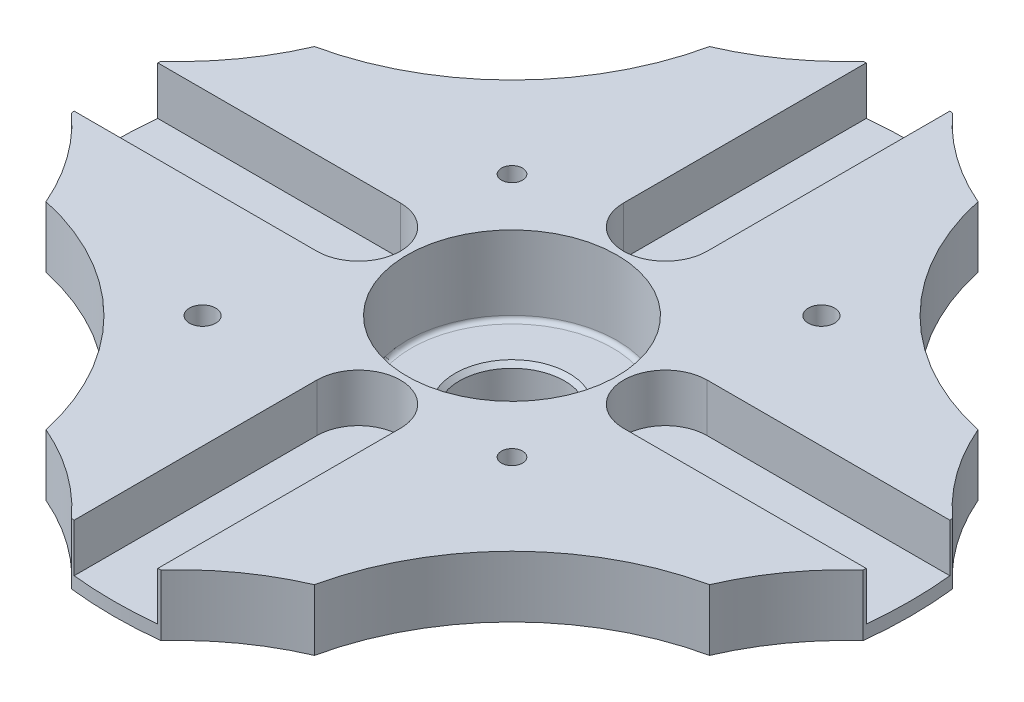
SolidWorks part; units mm, degrees
ref_plane "Plan1" through (0, 0, 0) normal (0, 0, 1) x (1, 0, 0)
ref_plane "Plan2" through (0, 0, 0) normal (0, 1, 0) x (1, 0, 0)
ref_plane "Plan3" through (0, 0, 0) normal (1, 0, 0) x (0, 0, -1)
sketch "Esquisse1" plane through (0, 0, 0) normal (0, 0, 1) x (1, 0, 0)
  line L0 (0, 0) -> (0, 107.1671) construction
  line L2 (24, 45.9) -> (24, 28)
  line L3 (24, 28) -> (12, 28)
  line L4 (12, 28) -> (12, 0)
  line L5 (12, 0) -> (19, 0)
  line L6 (19, 0) -> (19, 18)
  line L7 (19, 18) -> (29, 18)
  line L8 (29, 18) -> (29, 31.9)
  line L9 (29, 31.9) -> (91, 31.9)
  line L10 (91, 31.9) -> (91, 45.9)
  line L11 (24, 45.9) -> (91, 45.9)
  dimension "D1" = 91
  dimension "D2" = 29
  dimension "D3" = 19
  dimension "D4" = 24
  dimension "D5" = 12
  dimension "D6" = 14
  dimension "D7" = 13.9
  dimension "D8" = 18
  dimension "D9" = 17.9
revolve "Base-Révolution" add sketch "Esquisse1" angle 360 about L0
sketch "Esquisse2" plane through (0, 45.9, 0) normal (0, 1, 0) x (-1, 0, 0)
  line L0 (0, 0) -> (0, -95.8152) construction
  line L2 (9.55, -90.4975) -> (9.55, -35.05)
  line L4 (-9.55, -35.05) -> (-9.55, -90.4975)
  circle A0 centre (0, 0) radius 91 construction
  arc A1 (-9.55, -90.4975) -> (9.55, -90.4975) centre (0, 0) ccw
  arc A2 (9.55, -35.05) -> (-9.55, -35.05) centre (0, -35.05) ccw
  circle A3 centre (0, 0) radius 24 construction
  dimension "D2" = 25.5
  dimension "D1" = 19.1
extrude "Enlèv. mat.-Extru.1" cut sketch "Esquisse2" against normal blind 11
pattern_circular "Répétition circulaire1" count 4 every 90 about axis through (0, 0, 0) along (0, 1, 0) of "Enlèv. mat.-Extru.1"
sketch "Esquisse4" plane through (0, 45.9, 0) normal (0, 1, 0) x (-1, 0, 0)
  arc A0 (-10.2445, -90.4215) -> (-30.6717, -75.8078) centre (-54, -130) ccw
  arc A1 (-30.6717, -75.8078) -> (-75.8078, -30.6717) centre (-88.37, -88.37) ccw
  circle A3 centre (0, 0) radius 24 construction
  arc A4 (-90.4975, -9.55) -> (-9.55, -90.4975) centre (0, 0) ccw construction
  arc A5 (-90.4215, -10.2445) -> (-10.2445, -90.4215) centre (0, 0) ccw
  arc A6 (-75.8078, -30.6717) -> (-90.4215, -10.2445) centre (-130, -54) ccw
  dimension "D1" = 59
  dimension "D4" = 88.37
  dimension "D3" = 54
  dimension "D5" = 88.37
  dimension "D6" = 59.05
  dimension "D7" = 54
  dimension "D8" = 130
  dimension "D9" = 59
  dimension "D2" = 130
extrude "Enlèv. mat.-Extru.3" cut sketch "Esquisse4" against normal up to next
pattern_circular "Répétition circulaire3" count 4 every 90 about axis through (0, 0, 0) along (0, 1, 0) of "Enlèv. mat.-Extru.3"
other "Perçage1"
sketch "Esquisse6" plane through (0, 45.9, 0) normal (0, 1, 0) x (-1, 0, 0)
  circle A0 centre (28, -28) radius 2.4
  dimension "D1" = 4.8
  dimension "D2" = 28
  dimension "D3" = 28
pattern_circular "Répétition circulaire4" count 2 every 180 about axis through (0, 0, 0) along (0, 1, 0) of "Perçage1"
other "Perçage2"
sketch "Esquisse7" plane through (0, 45.9, 0) normal (0, 1, 0) x (-1, 0, 0)
  circle A0 centre (-35.35, -35.35) radius 3
  dimension "D1" = 6
  dimension "D2" = 35.35
  dimension "D3" = 35.35
pattern_circular "Répétition circulaire5" count 2 every 180 about axis through (0, 0, 0) along (0, 1, 0) of "Perçage2"
chamfer "Chanfrein1" distance 1 angle 45 1 edges at (0, 28, -12)
fillet "Congé1" radius 1 1 edges at (0, 28, -24)
ref_plane "Plan4" through (53.2398, 0, -53.2398) normal (-0.7071, 0, 0.7071) x (0.7071, 0, 0.7071)
sketch "Esquisse8" plane through (53.2398, 0, -53.2398) normal (-0.7071, 0, 0.7071) x (0.7071, 0, 0.7071)
  line L0 (31.9161, 45.9) -> (-31.9161, 45.9) construction
  circle A0 centre (0, 38.9) radius 1.6
  dimension "D1" = 3.2
  dimension "D2" = 7
extrude "Enlèv. mat.-Extru.5" cut sketch "Esquisse8" against normal up to surface (22.7622 mm away)
ref_plane "Plan5" through (-53.2398, 0, 53.2398) normal (0.7071, 0, -0.7071) x (-0.7071, 0, -0.7071)
sketch "Esquisse9" plane through (-53.2398, 0, 53.2398) normal (0.7071, 0, -0.7071) x (-0.7071, 0, -0.7071)
  circle A0 centre (0, 38.9) radius 1.6 construction
  circle A1 centre (0, 38.9) radius 1.6
extrude "Enlèv. mat.-Extru.6" cut sketch "Esquisse9" against normal up to surface (22.7622 mm away)
sketch "Esquisse10" [suppressed] plane through (0, 45.9, 0) normal (0, 1, 0) x (-1, 0, 0)
  arc A1 (-30.6717, -75.8078) -> (-75.8078, -30.6717) centre (-88.37, -88.37) ccw construction
  arc A2 (-40.6061, -53.6495) -> (-52.9698, -41.1076) centre (-88.37, -88.37) ccw
  spline_without_curve S0
extrude "Enlèv. mat.-Extru.7" [suppressed] cut sketch "Esquisse10" against normal blind 7
